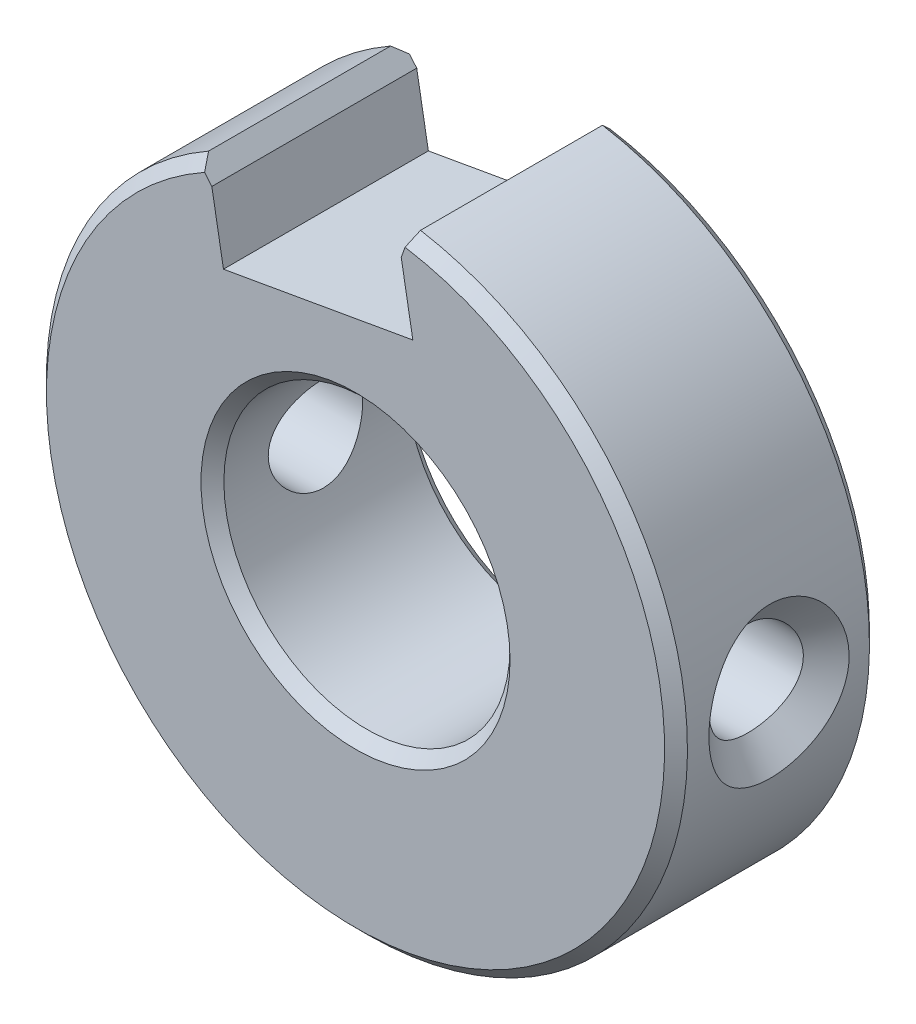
SolidWorks part; units mm, degrees
ref_plane "Plan1" through (0, 0, 0) normal (0, 0, 1) x (1, 0, 0)
ref_plane "Plan2" through (0, 0, 0) normal (0, 1, 0) x (1, 0, 0)
ref_plane "Plan3" through (0, 0, 0) normal (1, 0, 0) x (0, 0, -1)
sketch "Esquisse1" plane through (0, 0, 0) normal (0, 0, 1) x (1, 0, 0)
  line L0 (-30.2, 0) -> (32.8, 0) construction
  line L1 (0, -29.6) -> (0, 29.8) construction
  line L2 (0, 0) -> (-3.2646, 18.5144) construction
  line L3 (-12.5516, 22.8099) -> (-11.537, 17.0557)
  line L4 (-11.537, 17.0557) -> (5.0078, 19.973)
  line L5 (3.9932, 25.7272) -> (5.0078, 19.973)
  line L6 (-12.5516, 22.8099) -> (-13.8372, 24.342)
  line L7 (3.9932, 25.7272) -> (4.6772, 27.6066)
  arc A0 (-13.8372, 24.342) -> (4.6772, 27.6066) centre (0, 0) ccw
  circle A1 centre (0, 0) radius 12.5
  dimension "D1" = 25
  dimension "D2" = 56
  dimension "D4" = 18.8
  dimension "D3" = 10
  dimension "D5" = 16.8
  dimension "D6" = 30
  dimension "D7" = 1
  dimension "D9" = 30
extrude "Base-Extrusion" add sketch "Esquisse1" along normal blind 17.9
chamfer "Chanfrein1" distance 1 angle 45
sketch "Esquisse2" plane through (0, 0, 0) normal (1, 0, 0) x (0, 0, -1)
  line L0 (-16.9, 0) -> (-1, 0) construction
  line L1 (0, -27) -> (0, 26.6507) construction
  circle A0 centre (-8.9, 0) radius 4.125
  dimension "D2" = 8.25
  dimension "D1" = 8.9
extrude "Enlèv. mat.-Extru.1" cut sketch "Esquisse2" against normal mid plane 60
chamfer "Chanfrein2" distance 2 angle 45
